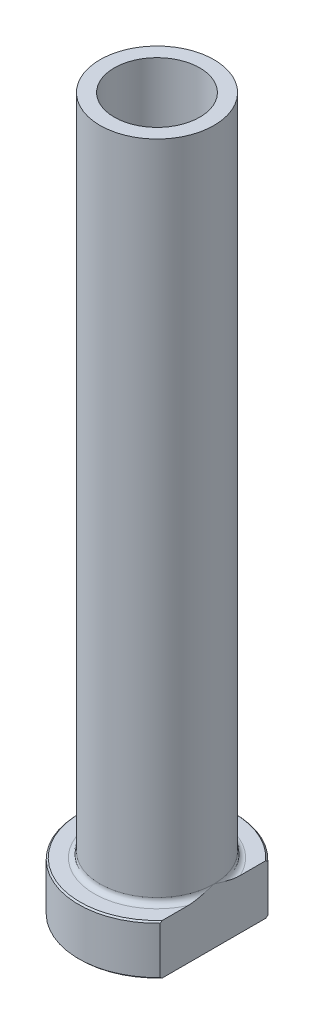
SolidWorks part; units mm, degrees
ref_plane "Front Plane" through (0, 0, 0) normal (0, 0, 1) x (1, 0, 0)
ref_plane "Top Plane" through (0, 0, 0) normal (0, 1, 0) x (1, 0, 0)
ref_plane "Right Plane" through (0, 0, 0) normal (1, 0, 0) x (0, 0, -1)
sketch "Sketch1" plane through (0, 0, 0) normal (0, 0, 1) x (1, 0, 0)
  line L0 (-6, 100) -> (-8, 100)
  line L1 (-8, 100) -> (-8, 7)
  line L2 (-8, 7) -> (-11, 7)
  line L3 (-11, 7) -> (-11, 0)
  line L4 (10.45, 0) -> (-10.45, 0) construction
  line L5 (-11, 0) -> (-6.25, 0)
  line L6 (-6, 45) -> (-6, 100)
  line L7 (0, 92.1877) -> (0, -15.5353) construction
  line L8 (0, -12.1) -> (0, 12.1) construction
  line L9 (-6, 45) -> (-6.25, 33)
  line L10 (-6.25, 33) -> (-6.25, 0)
  dimension "D1" = 0.25
  dimension "ID" = 12
  dimension "OD" = 16
  dimension "L" = 100
  dimension "H" = 22
  dimension "T" = 7
  dimension "N" = 55
  dimension "D2" = 12
  dimension "L-N" = 45
revolve "Revolve1" add sketch "Sketch1" angle 360 about L7
fillet "Fillet1" radius 0.8 1 edges at (0, 7, 8)
chamfer "Chamfer1" distance 0.2 angle 45 2 edges at (0, 7, 11) (0, 0, 11)
sketch "Sketch2" plane through (0, 0, 0) normal (0, -1, 0) x (1, 0, 0)
  line L0 (8, 7.5498) -> (8, -7.5498)
  circle A0 centre (0, 0) radius 11 construction
  arc A1 (8, 7.5498) -> (8, -7.5498) centre (0, 0) cw
  circle A2 centre (0, 0) radius 8 construction
extrude "Cut-Extrude1" cut sketch "Sketch2" against normal through all
chamfer "Chamfer2" distance 0.5 angle 45 1 edges at (0, 0, 6.25)
